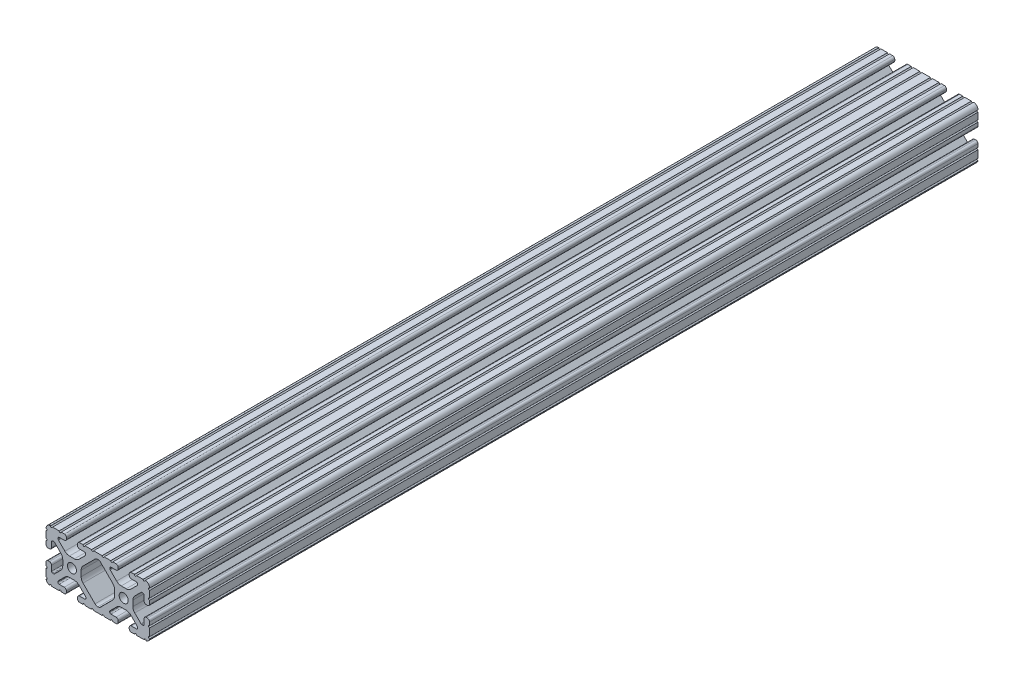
SolidWorks part; units mm, degrees
ref_plane "Front" through (0, 0, 0) normal (0, 0, 1) x (1, 0, 0)
ref_plane "Top" through (0, 0, 0) normal (0, 1, 0) x (1, 0, 0)
ref_plane "Right" through (0, 0, 0) normal (1, 0, 0) x (0, 0, -1)
sketch "Sketch1" plane through (0, 0, 0) normal (0, 0, 1) x (1, 0, 0)
  line L2 (30.3513, 26.5282) -> (39.1767, 35.3536)
  line L3 (40.5679, 38.7122) -> (40.5679, 42.8592)
  line L4 (39.1767, 46.2178) -> (30.3513, 55.0433)
  line L5 (26.1972, 55.0433) -> (17.3719, 46.2178)
  line L6 (15.9807, 42.8592) -> (15.9807, 38.7122)
  line L7 (17.3719, 35.3536) -> (26.1972, 26.5282)
  line L8 (37.19, 54.3201) -> (37.19, 54.8827)
  line L9 (38.079, 55.7717) -> (41.6855, 55.7717)
  line L10 (43.2603, 57.3465) -> (43.2603, 58.2825)
  line L11 (41.707, 59.8357) -> (39.2718, 59.8357)
  line L12 (37.7478, 59.8357) -> (32.9194, 59.8357)
  line L13 (31.3954, 59.8357) -> (25.1532, 59.8357)
  line L14 (23.6292, 59.8357) -> (18.8007, 59.8357)
  line L15 (17.2767, 59.8357) -> (14.8415, 59.8357)
  line L16 (13.2883, 58.2825) -> (13.2883, 57.3465)
  line L17 (14.8631, 55.7717) -> (18.4695, 55.7717)
  line L18 (19.3585, 54.8827) -> (19.3585, 54.3201)
  line L19 (19.0981, 53.6915) -> (14.4218, 49.0151)
  line L20 (11.0632, 47.6239) -> (7.3854, 47.6239)
  line L21 (4.0268, 49.0151) -> (-0.6496, 53.6915)
  line L22 (-0.91, 54.3201) -> (-0.91, 54.8827)
  line L23 (-0.021, 55.7717) -> (3.5855, 55.7717)
  line L24 (5.1603, 57.3465) -> (5.1603, 58.2663)
  line L25 (3.7154, 59.8357) -> (1.3285, 59.8357)
  line L26 (-0.1955, 59.8357) -> (-5.022, 59.8357)
  line L27 (-9.8257, 55.1609) -> (-9.8257, 50.3354)
  line L28 (-9.8257, 48.8114) -> (-9.8257, 46.4245)
  line L29 (-8.2509, 44.8497) -> (-7.3365, 44.8497)
  line L30 (-5.7617, 46.4245) -> (-5.7617, 50.1837)
  line L31 (-4.8727, 51.0727) -> (-4.1464, 51.0727)
  line L32 (-3.5178, 50.8123) -> (1.0767, 46.2178)
  line L33 (2.4679, 42.8592) -> (2.4679, 38.7122)
  line L34 (1.0767, 35.3536) -> (-3.5178, 30.7591)
  line L35 (-4.1464, 30.4987) -> (-4.8727, 30.4987)
  line L36 (-5.7617, 31.3877) -> (-5.7617, 35.1469)
  line L37 (-7.3365, 36.7217) -> (-8.2509, 36.7217)
  line L38 (-9.8257, 35.1469) -> (-9.8257, 32.76)
  line L39 (-9.8257, 31.236) -> (-9.8257, 25.7497)
  line L40 (-5.773, 21.7357) -> (-0.1955, 21.7357)
  line L41 (1.3285, 21.7357) -> (3.5855, 21.7357)
  line L42 (5.1603, 23.3105) -> (5.1603, 24.2249)
  line L43 (3.5855, 25.7997) -> (-0.1737, 25.7997)
  line L44 (-1.0627, 26.6887) -> (-1.0627, 27.0985)
  line L45 (-0.8023, 27.7272) -> (4.0268, 32.5563)
  line L46 (7.3854, 33.9475) -> (11.0632, 33.9475)
  line L47 (14.4218, 32.5563) -> (19.2509, 27.7272)
  line L48 (19.5113, 27.0985) -> (19.5113, 26.6887)
  line L49 (18.6223, 25.7997) -> (14.8631, 25.7997)
  line L50 (13.2883, 24.2249) -> (13.2883, 23.3105)
  line L51 (14.8631, 21.7357) -> (17.2767, 21.7357)
  line L52 (18.8007, 21.7357) -> (23.6292, 21.7357)
  line L53 (25.1532, 21.7357) -> (31.3954, 21.7357)
  line L54 (32.9194, 21.7357) -> (37.7478, 21.7357)
  line L55 (39.2718, 21.7357) -> (41.6855, 21.7357)
  line L56 (43.2603, 23.3105) -> (43.2603, 24.2249)
  line L57 (41.6855, 25.7997) -> (37.9263, 25.7997)
  line L58 (37.0373, 26.6887) -> (37.0373, 27.0985)
  line L59 (37.2977, 27.7272) -> (42.1268, 32.5563)
  line L60 (45.4854, 33.9475) -> (49.1632, 33.9475)
  line L61 (52.5218, 32.5563) -> (57.3509, 27.7272)
  line L62 (57.6113, 27.0985) -> (57.6113, 26.6887)
  line L63 (56.7223, 25.7997) -> (52.9631, 25.7997)
  line L64 (51.3883, 24.2249) -> (51.3883, 23.3105)
  line L65 (52.9631, 21.7357) -> (55.2201, 21.7357)
  line L66 (56.7441, 21.7357) -> (62.3216, 21.7357)
  line L67 (66.3743, 25.7497) -> (66.3743, 31.236)
  line L68 (66.3743, 32.76) -> (66.3743, 35.1469)
  line L69 (64.7995, 36.7217) -> (63.8851, 36.7217)
  line L70 (62.3103, 35.1469) -> (62.3103, 31.3877)
  line L71 (61.4213, 30.4987) -> (60.6949, 30.4987)
  line L72 (60.0663, 30.7591) -> (55.4719, 35.3536)
  line L73 (54.0807, 38.7122) -> (54.0807, 42.8592)
  line L74 (55.4719, 46.2178) -> (60.0663, 50.8123)
  line L75 (60.6949, 51.0727) -> (61.4213, 51.0727)
  line L76 (62.3103, 50.1837) -> (62.3103, 46.4245)
  line L77 (63.8851, 44.8497) -> (64.7995, 44.8497)
  line L78 (66.3743, 46.4245) -> (66.3743, 48.8114)
  line L79 (66.3743, 50.3354) -> (66.3743, 55.1609)
  line L80 (61.5705, 59.8357) -> (56.7441, 59.8357)
  line L81 (55.2201, 59.8357) -> (52.8332, 59.8357)
  line L82 (51.3883, 58.2663) -> (51.3883, 57.3465)
  line L83 (52.9631, 55.7717) -> (56.5695, 55.7717)
  line L84 (57.4585, 54.8827) -> (57.4585, 54.3201)
  line L85 (57.1981, 53.6915) -> (52.5218, 49.0151)
  line L86 (49.1632, 47.6239) -> (45.4854, 47.6239)
  line L87 (42.1268, 49.0151) -> (37.4504, 53.6915)
  arc A0 (39.1767, 35.3536) -> (40.5679, 38.7122) centre (35.8181, 38.7122) ccw
  arc A1 (30.3513, 55.0433) -> (28.2743, 55.8988) centre (28.2858, 52.9778) ccw
  arc A2 (28.2743, 55.8988) -> (26.1972, 55.0433) centre (28.2627, 52.9778) ccw
  arc A3 (17.3719, 46.2178) -> (15.9807, 42.8592) centre (20.7305, 42.8592) ccw
  arc A4 (15.9807, 38.7122) -> (17.3719, 35.3536) centre (20.7305, 38.7122) ccw
  arc A5 (26.1972, 26.5282) -> (28.2743, 25.6726) centre (28.2627, 28.5936) ccw
  arc A6 (28.2743, 25.6726) -> (30.3513, 26.5282) centre (28.2858, 28.5936) ccw
  circle A7 centre (47.3243, 40.7857) radius 3.3274
  circle A8 centre (9.2243, 40.7857) radius 3.3274
  arc A9 (40.5679, 42.8592) -> (39.1767, 46.2178) centre (35.8181, 42.8592) ccw
  arc A10 (38.079, 55.7717) -> (37.19, 54.8827) centre (38.079, 54.8827) ccw
  arc A11 (41.6855, 55.7717) -> (43.2603, 57.3465) centre (41.6855, 57.3465) ccw
  arc A12 (43.2603, 58.2825) -> (41.707, 59.8357) centre (41.707, 58.2825) ccw
  arc A13 (37.7478, 59.8357) -> (39.2718, 59.8357) centre (38.5098, 59.8357) ccw
  arc A14 (31.3954, 59.8357) -> (32.9194, 59.8357) centre (32.1574, 59.8357) ccw
  arc A15 (23.6292, 59.8357) -> (25.1532, 59.8357) centre (24.3912, 59.8357) ccw
  arc A16 (17.2767, 59.8357) -> (18.8007, 59.8357) centre (18.0387, 59.8357) ccw
  arc A17 (14.8415, 59.8357) -> (13.2883, 58.2825) centre (14.8415, 58.2825) ccw
  arc A18 (13.2883, 57.3465) -> (14.8631, 55.7717) centre (14.8631, 57.3465) ccw
  arc A19 (19.3585, 54.8827) -> (18.4695, 55.7717) centre (18.4695, 54.8827) ccw
  arc A20 (19.0981, 53.6915) -> (19.3585, 54.3201) centre (18.4695, 54.3201) ccw
  arc A21 (11.0632, 47.6239) -> (14.4218, 49.0151) centre (11.0632, 52.3737) ccw
  arc A22 (4.0268, 49.0151) -> (7.3854, 47.6239) centre (7.3854, 52.3737) ccw
  arc A23 (-0.91, 54.3201) -> (-0.6496, 53.6915) centre (-0.021, 54.3201) ccw
  arc A24 (-0.021, 55.7717) -> (-0.91, 54.8827) centre (-0.021, 54.8827) ccw
  arc A25 (3.5855, 55.7717) -> (5.1603, 57.3465) centre (3.5855, 57.3465) ccw
  arc A26 (5.1603, 58.2663) -> (3.7154, 59.8357) centre (3.5855, 58.2663) ccw
  arc A27 (-0.1955, 59.8357) -> (1.3285, 59.8357) centre (0.5665, 59.8357) ccw
  arc A28 (-6.5453, 59.8825) -> (-5.022, 59.8357) centre (-5.7836, 59.8591) ccw
  arc A29 (-6.5453, 59.8825) -> (-9.8633, 56.684) centre (-6.6287, 56.6488) ccw
  arc A30 (-9.8257, 55.1609) -> (-9.8633, 56.684) centre (-9.8257, 55.9229) ccw
  arc A31 (-9.8257, 48.8114) -> (-9.8257, 50.3354) centre (-9.8257, 49.5734) ccw
  arc A32 (-9.8257, 46.4245) -> (-8.2509, 44.8497) centre (-8.2509, 46.4245) ccw
  arc A33 (-7.3365, 44.8497) -> (-5.7617, 46.4245) centre (-7.3365, 46.4245) ccw
  arc A34 (-4.8727, 51.0727) -> (-5.7617, 50.1837) centre (-4.8727, 50.1837) ccw
  arc A35 (-3.5178, 50.8123) -> (-4.1464, 51.0727) centre (-4.1464, 50.1837) ccw
  arc A36 (2.4679, 42.8592) -> (1.0767, 46.2178) centre (-2.2819, 42.8592) ccw
  arc A37 (1.0767, 35.3536) -> (2.4679, 38.7122) centre (-2.2819, 38.7122) ccw
  arc A38 (-4.1464, 30.4987) -> (-3.5178, 30.7591) centre (-4.1464, 31.3877) ccw
  arc A39 (-5.7617, 31.3877) -> (-4.8727, 30.4987) centre (-4.8727, 31.3877) ccw
  arc A40 (-5.7617, 35.1469) -> (-7.3365, 36.7217) centre (-7.3365, 35.1469) ccw
  arc A41 (-8.2509, 36.7217) -> (-9.8257, 35.1469) centre (-8.2509, 35.1469) ccw
  arc A42 (-9.8257, 31.236) -> (-9.8257, 32.76) centre (-9.8257, 31.998) ccw
  arc A43 (-9.8257, 24.2257) -> (-9.8257, 25.7497) centre (-9.8257, 24.9877) ccw
  arc A44 (-9.8257, 24.2257) -> (-7.297, 21.7357) centre (-6.6712, 24.9002) ccw
  arc A45 (-5.773, 21.7357) -> (-7.297, 21.7357) centre (-6.535, 21.7357) ccw
  arc A46 (1.3285, 21.7357) -> (-0.1955, 21.7357) centre (0.5665, 21.7357) ccw
  arc A47 (3.5855, 21.7357) -> (5.1603, 23.3105) centre (3.5855, 23.3105) ccw
  arc A48 (5.1603, 24.2249) -> (3.5855, 25.7997) centre (3.5855, 24.2249) ccw
  arc A49 (-1.0627, 26.6887) -> (-0.1737, 25.7997) centre (-0.1737, 26.6887) ccw
  arc A50 (-0.8023, 27.7272) -> (-1.0627, 27.0985) centre (-0.1737, 27.0985) ccw
  arc A51 (7.3854, 33.9475) -> (4.0268, 32.5563) centre (7.3854, 29.1977) ccw
  arc A52 (14.4218, 32.5563) -> (11.0632, 33.9475) centre (11.0632, 29.1977) ccw
  arc A53 (19.5113, 27.0985) -> (19.2509, 27.7272) centre (18.6223, 27.0985) ccw
  arc A54 (18.6223, 25.7997) -> (19.5113, 26.6887) centre (18.6223, 26.6887) ccw
  arc A55 (14.8631, 25.7997) -> (13.2883, 24.2249) centre (14.8631, 24.2249) ccw
  arc A56 (13.2883, 23.3105) -> (14.8631, 21.7357) centre (14.8631, 23.3105) ccw
  arc A57 (18.8007, 21.7357) -> (17.2767, 21.7357) centre (18.0387, 21.7357) ccw
  arc A58 (25.1532, 21.7357) -> (23.6292, 21.7357) centre (24.3912, 21.7357) ccw
  arc A59 (32.9194, 21.7357) -> (31.3954, 21.7357) centre (32.1574, 21.7357) ccw
  arc A60 (39.2718, 21.7357) -> (37.7478, 21.7357) centre (38.5098, 21.7357) ccw
  arc A61 (41.6855, 21.7357) -> (43.2603, 23.3105) centre (41.6855, 23.3105) ccw
  arc A62 (43.2603, 24.2249) -> (41.6855, 25.7997) centre (41.6855, 24.2249) ccw
  arc A63 (37.0373, 26.6887) -> (37.9263, 25.7997) centre (37.9263, 26.6887) ccw
  arc A64 (37.2977, 27.7272) -> (37.0373, 27.0985) centre (37.9263, 27.0985) ccw
  arc A65 (45.4854, 33.9475) -> (42.1268, 32.5563) centre (45.4854, 29.1977) ccw
  arc A66 (52.5218, 32.5563) -> (49.1632, 33.9475) centre (49.1632, 29.1977) ccw
  arc A67 (57.6113, 27.0985) -> (57.3509, 27.7272) centre (56.7223, 27.0985) ccw
  arc A68 (56.7223, 25.7997) -> (57.6113, 26.6887) centre (56.7223, 26.6887) ccw
  arc A69 (52.9631, 25.7997) -> (51.3883, 24.2249) centre (52.9631, 24.2249) ccw
  arc A70 (51.3883, 23.3105) -> (52.9631, 21.7357) centre (52.9631, 23.3105) ccw
  arc A71 (56.7441, 21.7357) -> (55.2201, 21.7357) centre (55.9821, 21.7357) ccw
  arc A72 (63.8456, 21.7357) -> (62.3216, 21.7357) centre (63.0836, 21.7357) ccw
  arc A73 (63.8456, 21.7357) -> (66.3743, 24.2257) centre (63.2122, 24.9079) ccw
  arc A74 (66.3743, 25.7497) -> (66.3743, 24.2257) centre (66.3743, 24.9877) ccw
  arc A75 (66.3743, 32.76) -> (66.3743, 31.236) centre (66.3743, 31.998) ccw
  arc A76 (66.3743, 35.1469) -> (64.7995, 36.7217) centre (64.7995, 35.1469) ccw
  arc A77 (63.8851, 36.7217) -> (62.3103, 35.1469) centre (63.8851, 35.1469) ccw
  arc A78 (61.4213, 30.4987) -> (62.3103, 31.3877) centre (61.4213, 31.3877) ccw
  arc A79 (60.0663, 30.7591) -> (60.6949, 30.4987) centre (60.6949, 31.3877) ccw
  arc A80 (54.0807, 38.7122) -> (55.4719, 35.3536) centre (58.8305, 38.7122) ccw
  arc A81 (55.4719, 46.2178) -> (54.0807, 42.8592) centre (58.8305, 42.8592) ccw
  arc A82 (60.6949, 51.0727) -> (60.0663, 50.8123) centre (60.6949, 50.1837) ccw
  arc A83 (62.3103, 50.1837) -> (61.4213, 51.0727) centre (61.4213, 50.1837) ccw
  arc A84 (62.3103, 46.4245) -> (63.8851, 44.8497) centre (63.8851, 46.4245) ccw
  arc A85 (64.7995, 44.8497) -> (66.3743, 46.4245) centre (64.7995, 46.4245) ccw
  arc A86 (66.3743, 50.3354) -> (66.3743, 48.8114) centre (66.3743, 49.5734) ccw
  arc A87 (66.4119, 56.684) -> (66.3743, 55.1609) centre (66.3743, 55.9229) ccw
  arc A88 (66.4119, 56.684) -> (63.0938, 59.8825) centre (63.1773, 56.6488) ccw
  arc A89 (61.5705, 59.8357) -> (63.0938, 59.8825) centre (62.3322, 59.8591) ccw
  arc A90 (55.2201, 59.8357) -> (56.7441, 59.8357) centre (55.9821, 59.8357) ccw
  arc A91 (52.8332, 59.8357) -> (51.3883, 58.2663) centre (52.9631, 58.2663) ccw
  arc A92 (51.3883, 57.3465) -> (52.9631, 55.7717) centre (52.9631, 57.3465) ccw
  arc A93 (57.4585, 54.8827) -> (56.5695, 55.7717) centre (56.5695, 54.8827) ccw
  arc A94 (57.1981, 53.6915) -> (57.4585, 54.3201) centre (56.5695, 54.3201) ccw
  arc A95 (49.1632, 47.6239) -> (52.5218, 49.0151) centre (49.1632, 52.3737) ccw
  arc A96 (42.1268, 49.0151) -> (45.4854, 47.6239) centre (45.4854, 52.3737) ccw
  arc A97 (37.19, 54.3201) -> (37.4504, 53.6915) centre (38.079, 54.3201) ccw
extrude "Extrude1" add sketch "Sketch1" along normal blind 609.6
sketch "Sketch3" plane through (66.3743, 0, 0) normal (1, 0, 0) x (0, 0, -1)
  line L0 (0, 38.7122) -> (0, 42.8592) construction
  line L1 (0, 59.8836) -> (-609.6, 59.8836) construction
  line L2 (-609.6, 38.7122) -> (-609.6, 42.8592) construction
  line L3 (-609.6, 21.7357) -> (0, 21.7357) construction
  circle A0 centre (-19.05, 40.8336) radius 3.5719
  circle A1 centre (-57.15, 40.8336) radius 3.5719
  circle A2 centre (-590.55, 40.8336) radius 3.5719
  circle A3 centre (-552.45, 40.7857) radius 3.5719
  point P4 (0, 40.7857)
  point P13 (-609.6, 40.7857)
  dimension "D1" = 7.1437
  dimension "D2" = 7.1437
  dimension "D7" = 7.1437
  dimension "D8" = 7.1437
  dimension "D3" = 19.05
  dimension "D4" = 19.05
  dimension "D5" = 19.05
  dimension "D6" = 38.1
  dimension "D9" = 19.05
  dimension "D10" = 19.05
  dimension "D11" = 19.05
  dimension "D12" = 38.1
extrude "Extrude3" cut sketch "Sketch3" against normal blind 76.2
